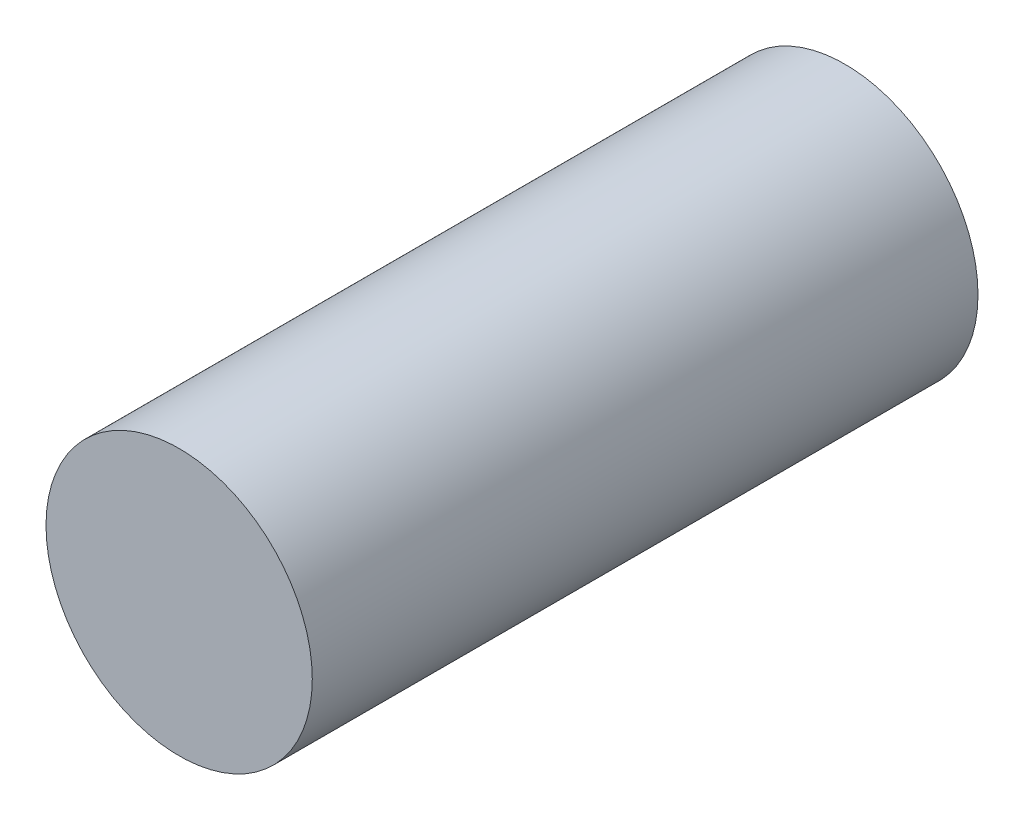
SolidWorks part; units mm, degrees
ref_plane "Front Plane" through (0, 0, 0) normal (0, 0, 1) x (1, 0, 0)
ref_plane "Top Plane" through (0, 0, 0) normal (0, 1, 0) x (1, 0, 0)
ref_plane "Right Plane" through (0, 0, 0) normal (1, 0, 0) x (0, 0, -1)
sketch "Sketch1" plane through (0, 0, 0) normal (0, 0, 1) x (1, 0, 0)
  circle A0 centre (0, 0) radius 1.27
  dimension "D1" = 2.54
extrude "Boss-Extrude1" add sketch "Sketch1" along normal blind 6.35
